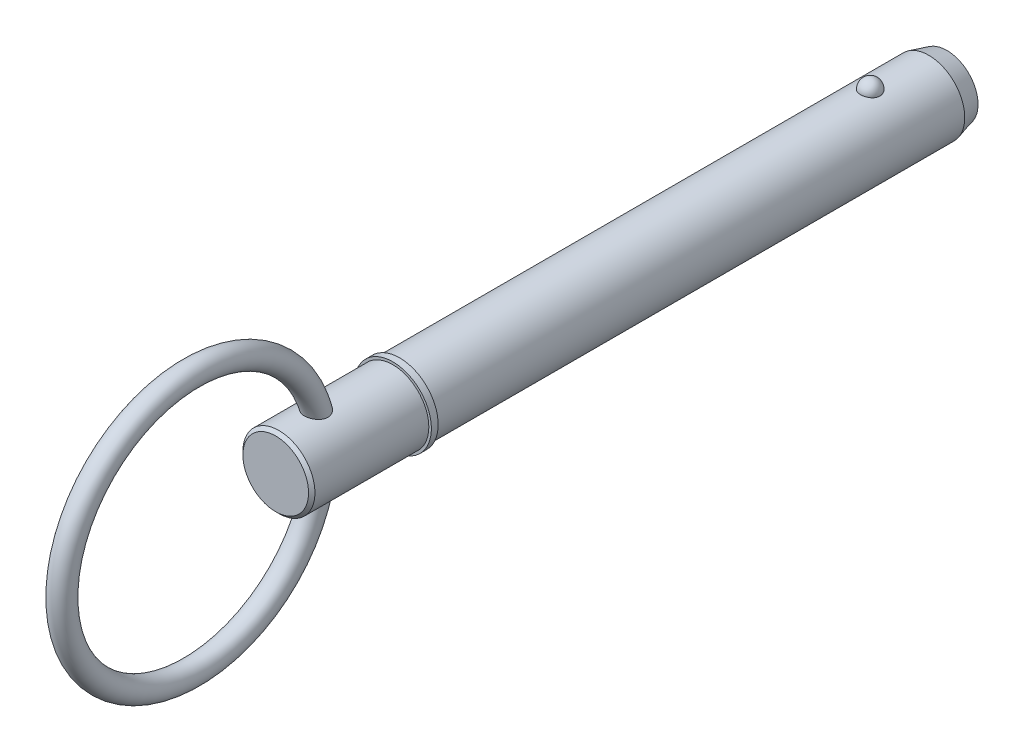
SolidWorks part; units mm, degrees
ref_plane "Front Plane" through (0, 0, 0) normal (0, 0, 1) x (1, 0, 0)
ref_plane "Top Plane" through (0, 0, 0) normal (0, 1, 0) x (1, 0, 0)
ref_plane "Right Plane" through (0, 0, 0) normal (1, 0, 0) x (0, 0, -1)
sketch "Sketch2" plane through (0, 0, 0) normal (0, 0, 1) x (1, 0, 0)
  circle A0 centre (0, 0) radius 7.94
  point P3 (0, 7.94)
  dimension "D1" = 15.88
extrude "Boss-Extrude1" add sketch "Sketch2" along normal blind 101.6
sketch "Sketch3" plane through (0, 0, 0) normal (0, 0, -1) x (-1, 0, 0)
  circle A0 centre (0, 0) radius 7.94
  dimension "D1" = 15.88
extrude "Boss-Extrude2" add sketch "Sketch3" along normal blind 19.05
chamfer "Chamfer1" distance 4 angle 15 1 edges at (-7.94, 0, -19.05)
sketch "Sketch18" plane through (0, 0, 0) normal (1, 0, 0) x (0, 0, -1)
  line L0 (15.05, 7.94) -> (-101.6, 7.94) construction
  line L1 (2.15, 10.09) -> (2.15, 5.79)
  line L2 (-101.6, -7.94) -> (15.05, -7.94) construction
  arc A0 (2.15, 10.09) -> (2.15, 5.79) centre (2.15, 7.94) ccw
  point P4 (0, 7.94)
  dimension "D1" = 18.03
revolve "Revolve1" add sketch "Sketch18" angle 360 about L1
sketch "Sketch19" plane through (0, 0, 0) normal (1, 0, 0) x (0, 0, -1)
  line L0 (-33.7288, 0) -> (-46.4542, 0) construction
sketch "Sketch20" plane through (0, 0, 0) normal (1, 0, 0) x (0, 0, -1)
  line L0 (-101.6, 0) -> (-101.6, 8.5)
  line L1 (-101.6, 7.94) -> (-101.6, -7.94) construction
  line L2 (-101.6, 8.5) -> (-103.1, 8.5)
  line L3 (-103.1, 8.5) -> (-103.1, 0)
  line L4 (-33.7288, 0) -> (-46.4542, 0) construction
  line L5 (-103.1, 0) -> (-101.6, 0)
  dimension "D1" = 8.5
  dimension "D2" = 1.5
revolve "Revolve2" add sketch "Sketch20" angle 360 about L0
sketch "Sketch21" plane through (0, 0, 101.6) normal (0, 0, -1) x (-1, 0, 0)
  circle A0 centre (0, 0) radius 7.94
  dimension "D1" = 15.88
extrude "Boss-Extrude3" add sketch "Sketch21" against normal blind 27.31
chamfer "Chamfer2" distance 0.7 angle 45 1 edges at (-7.94, 0, 128.91)
sketch "Sketch23" plane through (0, 0, 0) normal (1, 0, 0) x (0, 0, -1)
  line L0 (-128.91, 7.24) -> (-128.91, -7.24) construction
  circle A0 centre (-147.485, 0) radius 28.575
  point P2 (-118.91, 0)
  dimension "D1" = 57.15
  dimension "D2" = 10
sketch "Sketch24" plane through (0, 0, 0) normal (0, 1, 0) x (1, 0, 0)
  circle A0 centre (0, -118.91) radius 2.5
  dimension "D1" = 5
sweep "Sweep1" add profiles "Sketch24" path "Sketch23"
